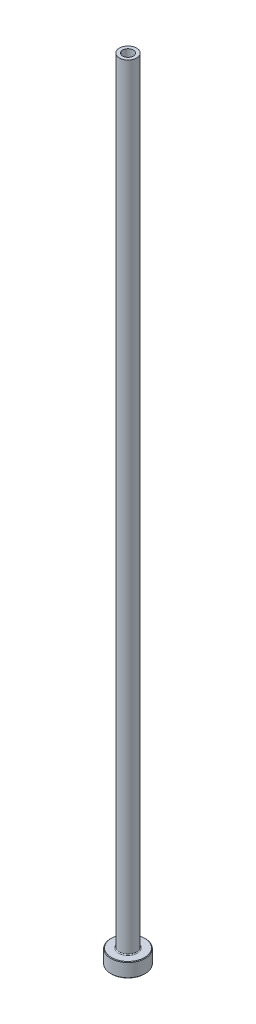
SolidWorks part; units mm, degrees
ref_plane "Front Plane" through (0, 0, 0) normal (0, 0, 1) x (1, 0, 0)
ref_plane "Top Plane" through (0, 0, 0) normal (0, 1, 0) x (1, 0, 0)
ref_plane "Right Plane" through (0, 0, 0) normal (1, 0, 0) x (0, 0, -1)
sketch "Sketch1" plane through (0, 0, 0) normal (0, 0, 1) x (1, 0, 0)
  line L0 (-1.85, 275) -> (-3, 275)
  line L1 (-3, 275) -> (-3, 5)
  line L2 (-3, 5) -> (-6, 5)
  line L3 (-6, 5) -> (-6, 0)
  line L4 (6.6, 0) -> (-6.6, 0) construction
  line L5 (-6, 0) -> (-2.1, 0)
  line L6 (-1.85, 230) -> (-1.85, 275)
  line L7 (0, 92.1877) -> (0, -15.5353) construction
  line L8 (0, -6.6) -> (0, 6.6) construction
  line L9 (-1.85, 230) -> (-2.1, 218)
  line L10 (-2.1, 218) -> (-2.1, 0)
  dimension "D1" = 0.25
  dimension "ID" = 3.7
  dimension "OD" = 6
  dimension "L" = 275
  dimension "H" = 12
  dimension "T" = 5
  dimension "N" = 45
  dimension "D2" = 12
revolve "Revolve1" add sketch "Sketch1" angle 360 about L7
fillet "Fillet1" radius 0.3 1 edges at (0, 5, 3)
chamfer "Chamfer1" distance 0.2 angle 45 2 edges at (0, 5, 6) (0, 0, 6)
chamfer "Chamfer3" distance 0.5 angle 45 1 edges at (0, 0, 2.1)
